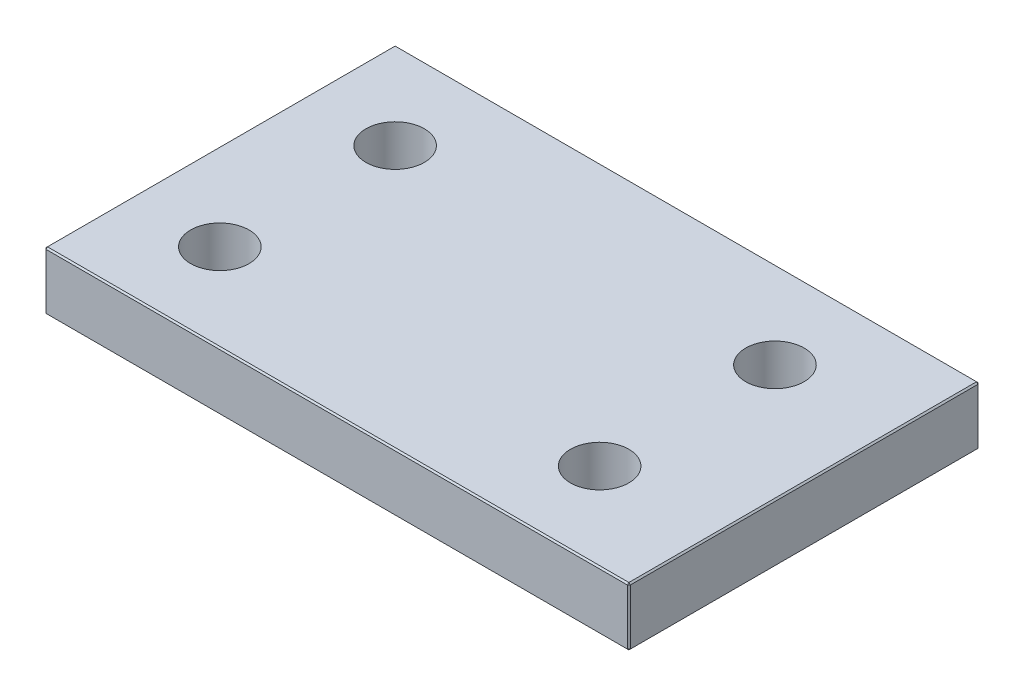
SolidWorks part; units mm, degrees
ref_plane "Front" through (0, 0, 0) normal (0, 0, 1) x (1, 0, 0)
ref_plane "Top" through (0, 0, 0) normal (0, 1, 0) x (1, 0, 0)
ref_plane "Right" through (0, 0, 0) normal (1, 0, 0) x (0, 0, -1)
sketch "Sketch1" plane through (0, 0, 0) normal (0, 1, 0) x (1, 0, 0)
  line L0 (50, -30) -> (-50, 30) construction
  line L1 (-50, 30) -> (50, 30)
  line L2 (-50, 30) -> (-50, -30)
  line L3 (-50, -30) -> (50, -30)
  line L4 (50, 30) -> (50, -30)
  dimension "D1" = 100
  dimension "D2" = 60
extrude "Extrude1" add sketch "Sketch1" along normal blind 10
chamfer "Chamfer1" distance 0.25 angle 45 12 edges at (-50, 5, -30) (0, 0, -30) (-50, 0, 0) (0, 10, -30) (-50, 10, 0) (50, 10, 0) (50, 5, -30) (50, 0, 0) (-50, 5, 30) (0, 10, 30) (50, 5, 30) (0, 0, 30)
hole_wizard "#97 (0.0059) Diameter Hole1" positions "Sketch11" profile "Sketch10" hole size "#97" standard "Ansi Inch"
sketch "Sketch11" plane through (0, 10, 0) normal (0, 1, 0) x (-1, 0, 0)
  line L0 (50, 29.75) -> (50, -29.75) construction
  line L1 (-49.75, 30) -> (49.75, 30) construction
  point P0 (35, 15)
  dimension "D1" = 15
  dimension "D2" = 15
sketch "Sketch10" plane through (-35, 10, 15) normal (1, 0, 0) x (0, 0, 1)
  line L0 (0, 0) -> (0, 13.0043)
  line L1 (0, 13.0043) -> (5, 10)
  line L2 (5, 10) -> (5, 0)
  line L5 (5, 0) -> (0, 0)
  line L10 (0, 13.0043) -> (-5, 10) construction
  line L11 (0, -6.35) -> (0, 107.95) construction
  dimension "Hole Dia." = 10
  dimension "Hole Depth" = 10
  dimension "Drill Angle" = 118
pattern_linear "LPattern4" count 2 spacing 65 along (1, 0, 0) count 2 spacing 30 along (0, 0, -1) of "#97 (0.0059) Diameter Hole1"
